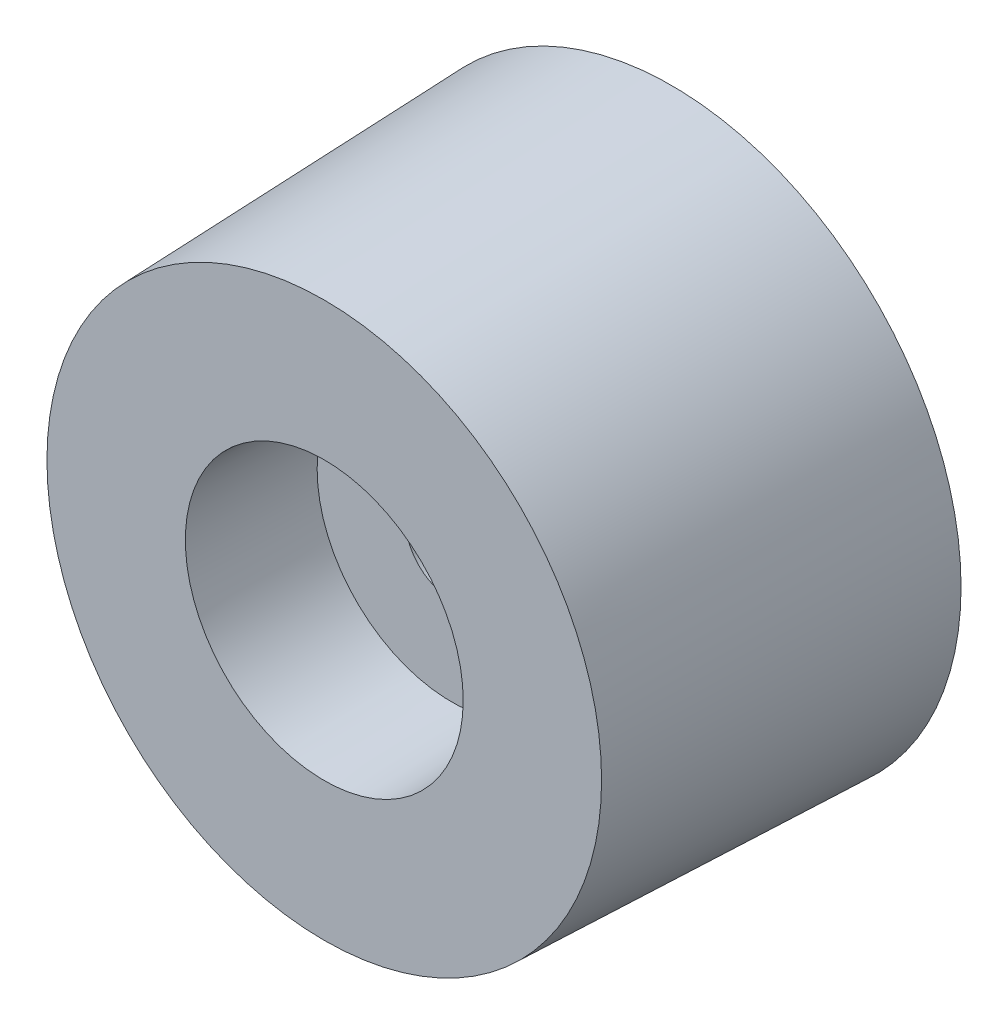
SolidWorks part; units mm, degrees
ref_plane "Plane1" through (0, 0, 0) normal (0, 0, 1) x (1, 0, 0)
ref_plane "Plane2" through (0, 0, 0) normal (0, 1, 0) x (1, 0, 0)
ref_plane "Plane3" through (0, 0, 0) normal (1, 0, 0) x (0, 0, -1)
sketch "Esquisse1" plane through (0, 0, 0) normal (0, 0, 1) x (1, 0, 0)
  circle A0 centre (0, 0) radius 12.5
  dimension "D1" = 25
extrude "BaseExtrusion" add sketch "Esquisse1" along normal blind 15 draft 2
sketch "Esquisse2" plane through (0, 0, 15) normal (0, 0, 1) x (1, 0, 0)
  circle A0 centre (0, 0) radius 6
  dimension "D1" = 12
extrude "Couper-Extrusion1" cut sketch "Esquisse2" against normal blind 5.5 draft 2
sketch "Esquisse3" plane through (0, 0, 9.5) normal (0, 0, 1) x (1, 0, 0)
  circle A0 centre (0, 0) radius 2
  dimension "D1" = 4
extrude "Couper-Extrusion2" cut sketch "Esquisse3" against normal through all
